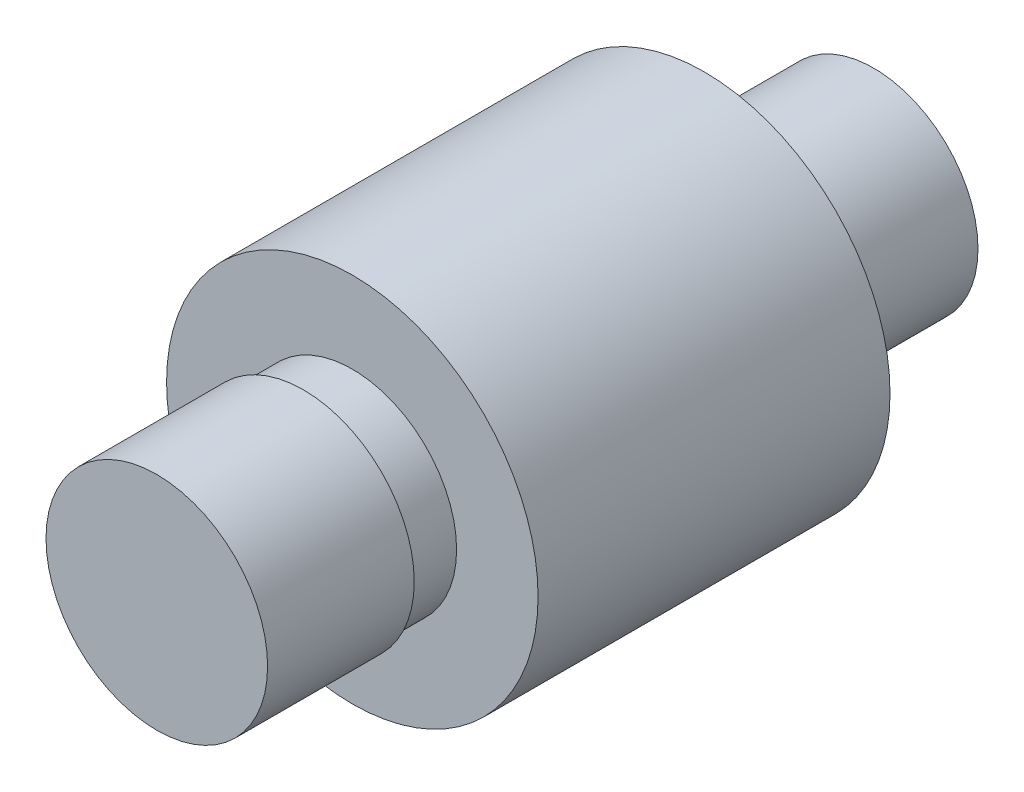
SolidWorks part; units mm, degrees
ref_plane "Front Plane" through (0, 0, 0) normal (0, 0, 1) x (1, 0, 0)
ref_plane "Top Plane" through (0, 0, 0) normal (0, 1, 0) x (1, 0, 0)
ref_plane "Right Plane" through (0, 0, 0) normal (1, 0, 0) x (0, 0, -1)
sketch "Sketch1" plane through (0, 0, 0) normal (0, 0, 1) x (1, 0, 0)
  circle A0 centre (0, 0) radius 85
  dimension "D1" = 170
extrude "Boss-Extrude1" add sketch "Sketch1" along normal blind 112.5
sketch "Sketch2" plane through (0, 0, 0) normal (0, 0, -1) x (-1, 0, 0)
  circle A0 centre (0, 0) radius 80
  dimension "D1" = 160
extrude "Boss-Extrude2" add sketch "Sketch2" along normal blind 37.5
sketch "Sketch3" plane through (0, 0, -37.5) normal (0, 0, -1) x (-1, 0, 0)
  circle A0 centre (0, 0) radius 142.5
  dimension "D1" = 285
extrude "Boss-Extrude3" add sketch "Sketch3" along normal blind 270
sketch "Sketch4" plane through (0, 0, -307.5) normal (0, 0, -1) x (-1, 0, 0)
  circle A0 centre (0, 0) radius 80
  dimension "D1" = 160
extrude "Boss-Extrude4" add sketch "Sketch4" along normal blind 130
